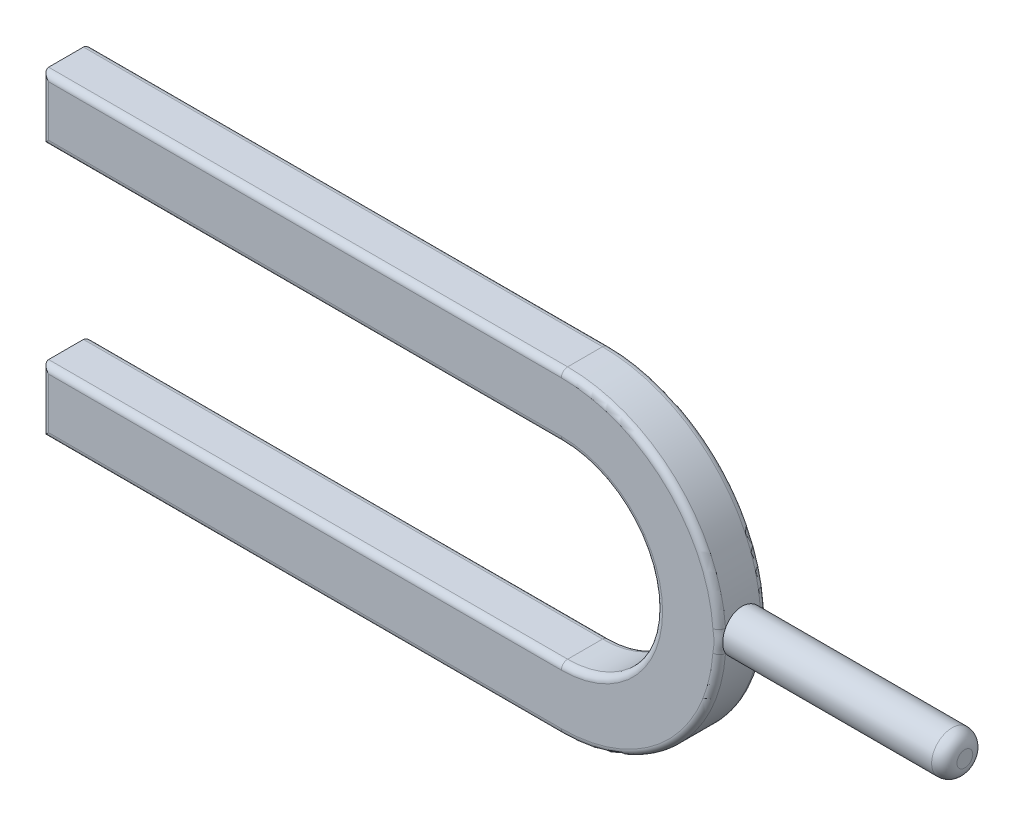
SolidWorks part; units mm, degrees
ref_plane "Front" through (0, 0, 0) normal (0, 0, 1) x (1, 0, 0)
ref_plane "Top" through (0, 0, 0) normal (0, 1, 0) x (1, 0, 0)
ref_plane "Right" through (0, 0, 0) normal (1, 0, 0) x (0, 0, -1)
sketch "Sketch1" plane through (0, 0, 0) normal (0, 0, 1) x (1, 0, 0)
  line L0 (-82, 15) -> (0, 15)
  line L1 (0, -15) -> (-82, -15)
  line L2 (-82, -15) -> (-82, -25)
  line L3 (-82, -25) -> (0, -25)
  line L4 (-82, 15) -> (-82, 25)
  line L5 (-82, 25) -> (0, 25)
  arc A0 (0, 15) -> (0, -15) centre (0, 0) cw
  arc A1 (0, 25) -> (0, -25) centre (0, 0) cw
  dimension "D4" = 25
  dimension "D1" = 82
  dimension "D2" = 10
  dimension "D3" = 82
extrude "Boss-Extrude1" add sketch "Sketch1" along normal mid plane 7.5
ref_plane "Plane1" through (60, 0, 0) normal (1, 0, 0) x (0, 0, -1)
sketch "Sketch2" plane through (60, 0, 0) normal (1, 0, 0) x (0, 0, -1)
  circle A0 centre (0, 0) radius 3.25
  dimension "D1" = 6.5
extrude "Boss-Extrude3" add sketch "Sketch2" against normal up to surface (35 mm away)
fillet "Fillet2" radius 2 1 edges at (60, 0, -3.25)
fillet "Fillet5" radius 1 16 edges at (-41, 25, 3.75) (25, 0, 3.75) (-41, -25, 3.75) (-82, -20, 3.75) (-41, -15, 3.75) (15, 0, 3.75) (-41, 15, 3.75) (-82, 20, 3.75) (-41, 15, -3.75) (15, 0, -3.75) (-41, -15, -3.75) (-82, -20, -3.75) (-41, -25, -3.75) (25, 0, -3.75) (-41, 25, -3.75) (-82, 20, -3.75)
